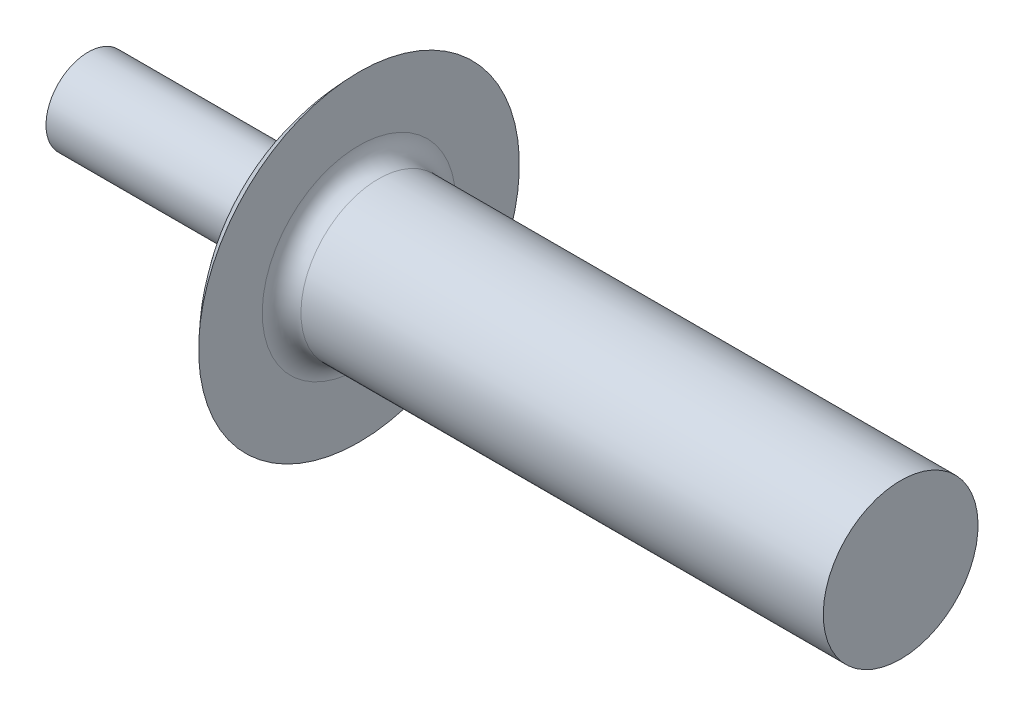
SolidWorks part; units mm, degrees
ref_plane "Front" through (0, 0, 0) normal (0, 0, 1) x (1, 0, 0)
ref_plane "Top" through (0, 0, 0) normal (0, 1, 0) x (1, 0, 0)
ref_plane "Right" through (0, 0, 0) normal (1, 0, 0) x (0, 0, -1)
sketch "Sketch1" plane through (13.2414, 10.1214, 0) normal (0, 0, 1) x (0, 1, 0)
  line L0 (-10.1214, -7.7586) -> (-8.1214, -7.7586)
  line L1 (-8.1214, -7.7586) -> (-8.1214, 6.2414)
  line L2 (-8.1214, 6.2414) -> (-5.9764, 6.2414)
  line L3 (-10.1214, 34.3377) -> (-10.1214, -10.975) construction
  line L4 (-9.0314, 7.8399) -> (-9.0314, 13.2414)
  line L5 (-9.0314, 13.2414) -> (-10.1214, 13.2414)
  line L6 (-10.1214, -7.7586) -> (-10.1214, 13.2414)
  arc A0 (-5.9764, 6.2414) -> (-9.0314, 7.8399) centre (-10.1214, 2.0381) ccw
  dimension "l" = 14
  dimension "D2" = 7
  dimension "d" = 4
  dimension "dk" = 8.29
  dimension "d1" = 2.18
  dimension "K" = 1.7
revolve "Base-Revolve" add sketch "Sketch1" angle 360 about L3
fillet "Fillet1" radius 0.5 1 edges at (7, -2, 0)
equation "\"D2@Sketch1\" = \"l@Sketch1\" / 2"
